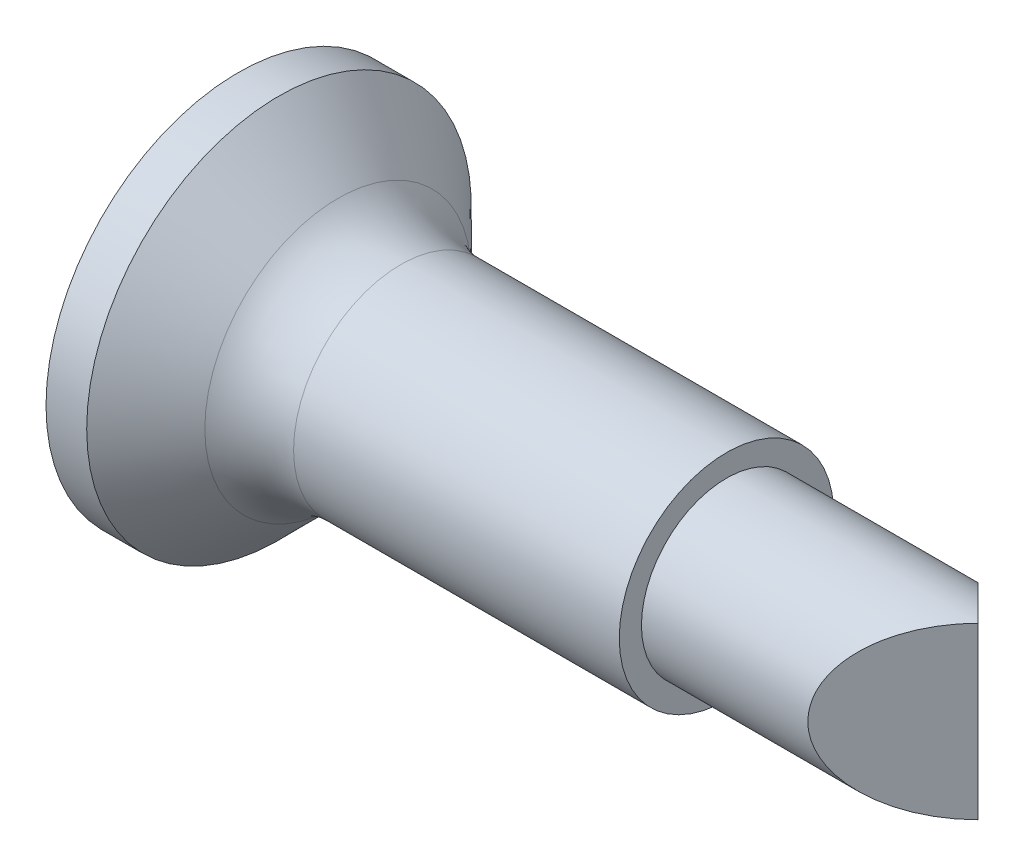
SolidWorks part; units mm, degrees
ref_plane "Front" through (0, 0, 0) normal (0, 0, 1) x (1, 0, 0)
ref_plane "Top" through (0, 0, 0) normal (0, 1, 0) x (1, 0, 0)
ref_plane "Right" through (0, 0, 0) normal (1, 0, 0) x (0, 0, -1)
sketch "Sketch1" plane through (0, 0, 0) normal (0, 0, 1) x (1, 0, 0)
  line L0 (-9.543, 0) -> (15.0934, 0) construction
  line L1 (0, 0) -> (0, 2.6)
  line L2 (0, 2.6) -> (0.55, 2.6)
  line L3 (0.55, 2.6) -> (1.7, 1.45)
  line L4 (1.7, 1.45) -> (6.6, 1.45)
  line L5 (6.6, 1.45) -> (6.6, 1.15)
  line L6 (6.6, 1.15) -> (10, 1.15)
  line L7 (10, 1.15) -> (10, 0)
  line L8 (0, 0) -> (10, 0)
  line L9 (2.8, 2.114) -> (2.8, 0.3277) construction
  dimension "D1" = 45
  dimension "dk" = 5.2
  dimension "d" = 2.9
  dimension "dp" = 2.3
  dimension "k" = 1.7
  dimension "l" = 10
  dimension "lg" = 6.6
  dimension "a" = 1.1
revolve "Base" add sketch "Sketch1" angle 360 about L0
fillet "Fillet1" radius 1.2 1 edges at (1.7, 0, 1.45)
sketch "Sketch2" plane through (0, 0, 0) normal (0, 1, 0) x (1, 0, 0)
  line L0 (10.757, 0) -> (13.5461, 0) construction
  line L2 (10.3703, -10) -> (10.3703, 10)
  line L3 (10.3703, 10) -> (0, 10)
  line L4 (0, 10) -> (10, 0)
  line L5 (-9.543, 0) -> (15.0934, 0) construction
  line L7 (0, -10) -> (10, 0)
  line L8 (10.3703, -10) -> (0, -10)
  line L9 (10, -1.15) -> (10, 1.15) construction
  dimension "D1" = 45
  dimension "D2" = 10
  dimension "D3" = 0.3703
extrude "Cut-Extrude1" cut sketch "Sketch2" against normal through all and the other way through all
sketch "Sketch3" plane through (0, 0, 0) normal (1, 0, 0) x (0, 0, -1)
  line L0 (-3.1307, 0) -> (3.313, 0) construction
  line L1 (0, -3.2902) -> (0, 3.0927) construction
  line L2 (-0.32, 0.32) -> (-1.6, 0.32)
  line L3 (0.32, -1.6) -> (-0.32, -1.6)
  line L4 (0.32, -1.6) -> (0.32, -0.32)
  line L5 (0.32, 1.6) -> (-0.32, 1.6)
  line L6 (-0.32, -1.6) -> (-0.32, -0.32)
  line L7 (1.6, 0.32) -> (0.32, 0.32)
  line L8 (1.6, 0.32) -> (1.6, -0.32)
  line L9 (1.6, -0.32) -> (0.32, -0.32)
  line L10 (-1.6, 0.32) -> (-1.6, -0.32)
  line L11 (-0.32, 0.32) -> (-0.32, 1.6)
  line L12 (0.32, 0.32) -> (0.32, 1.6)
  line L13 (-0.32, -0.32) -> (-1.6, -0.32)
  dimension "D1" = 3.2
  dimension "m" = 3.2
  dimension "D3" = 0.64
  dimension "D4" = 0.64
extrude "CrossRecess" cut sketch "Sketch3" along normal blind 0.5667
fillet "Fillet2" radius 0.32 4 edges at (0.2833, 0.32, 0.32) (0.2833, -0.32, 0.32) (0.2833, 0.32, -0.32) (0.2833, -0.32, -0.32)
draft "Draft1" type of draft neutral plane draft angle 25 faces to draft 4 parameters "D1"=25
sketch "Sketch4" plane through (0, 0, 0) normal (1, 0, 0) x (0, 0, -1)
  line L0 (-3.0699, 0) -> (3.2219, 0) construction
  line L1 (0, -3.1383) -> (0, 3.0775) construction
  line L2 (0, 0) -> (2.9162, 2.9162) construction
  line L3 (0, 0) -> (-2.8015, 2.8015) construction
  line L4 (0, 0.4782) -> (1.1314, 1.1314)
  line L5 (1.1314, 1.1314) -> (0.4782, 0)
  line L6 (0, 0.4782) -> (-1.1314, 1.1314)
  line L7 (-1.1314, 1.1314) -> (-0.4782, 0)
  line L8 (-1.1314, -1.1314) -> (-0.4782, 0)
  line L9 (0, -0.4782) -> (-1.1314, -1.1314)
  line L10 (1.1314, -1.1314) -> (0.4782, 0)
  line L11 (0, -0.4782) -> (1.1314, -1.1314)
  dimension "D1" = 45
  dimension "D2" = 15
  dimension "D3" = 3.2
extrude "Cut-Extrude3" [suppressed] cut sketch "Sketch4" along normal blind 0.5667
sketch "Sketch5" plane through (0, 0, 0) normal (0, 0, 1) x (1, 0, 0)
  line L0 (0, 0) -> (10.3232, 0) construction
  line L1 (2.6268, 1.7964) -> (2.9732, 1.7964)
  line L2 (2.9732, 1.7964) -> (2.9732, 1.45)
  line L3 (2.9732, 1.45) -> (2.8, 1.15)
  line L4 (2.8, 1.15) -> (2.6268, 1.45)
  line L5 (2.6268, 1.45) -> (2.6268, 1.7964)
  line L6 (0, 2.6) -> (0, -2.6) construction
  dimension "D1" = 2.8
  dimension "D2" = 2.9
  dimension "D3" = 2.3
revolve "Cut-Revolve10" [suppressed] cut sketch "Sketch5" angle 360 about L0
pattern_linear "LPattern10" [suppressed] count 9 spacing 0.45 along (1, 0, 0)
equation "\"D1@Sketch3\" = \"m@Sketch3\""
equation "\"D4@Sketch3\" = \"D3@Sketch3\""
equation "\"D3@Sketch3\" = \"m@Sketch3\" / 5"
equation "\"D1@Fillet2\" = \"D4@Sketch3\" / 2"
equation "\"D1@Cut-Extrude3\" = \"D1@CrossRecess\""
equation "\"D1@CrossRecess\" = \"k@Sketch1\" / 3"
equation "\"D1@ThreadCosmetic1\" = \"lg@Sketch1\" - \"k@Sketch1\""
equation "\"D2@ThreadCosmetic1\" = \"dp@Sketch1\""
equation "\"D3@Sketch4\" = \"D1@Sketch3\""
equation "\"D1@Sketch5\" = \"k@Sketch1\" + \"a@Sketch1\""
equation "\"D2@Sketch5\" = \"d@Sketch1\""
equation "\"D3@Sketch5\" = \"dp@Sketch1\""
equation "\"D3@LPattern10\" =  ( \"d@Sketch1\" - \"dp@Sketch1\" )  / 2 * 1.5"
equation "\"D1@LPattern10\" = (  \"lg@Sketch1\" - \"k@Sketch1\" - \"a@Sketch1\" )  / \"D3@LPattern10\" + 1"
